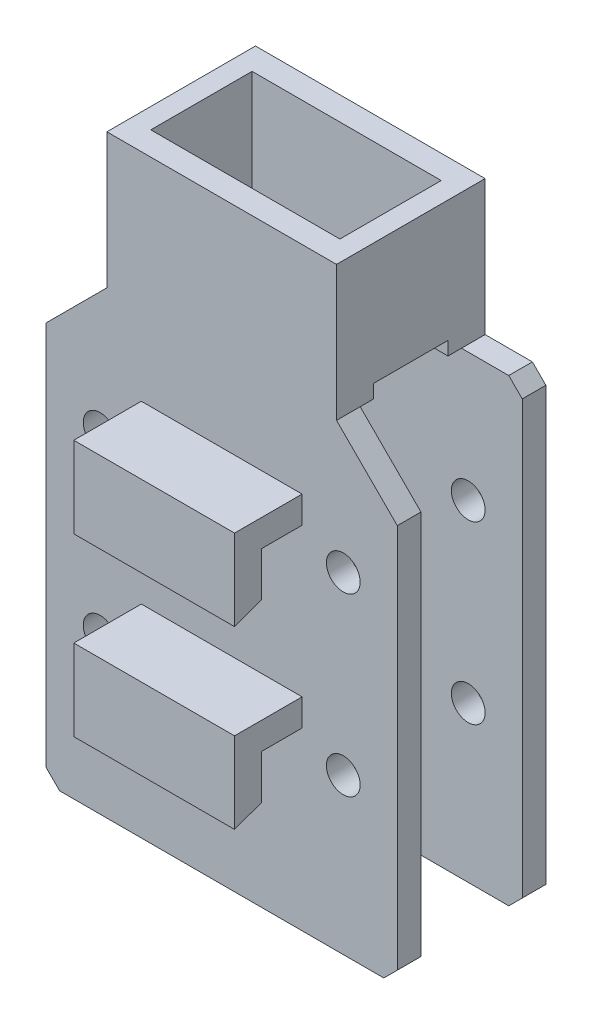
SolidWorks part; units mm, degrees
ref_plane "前视基准面" through (0, 0, 0) normal (0, 0, 1) x (1, 0, 0)
ref_plane "上视基准面" through (0, 0, 0) normal (0, 1, 0) x (1, 0, 0)
ref_plane "右视基准面" through (0, 0, 0) normal (1, 0, 0) x (0, 0, -1)
sketch "草图1" plane through (0, 0, 0) normal (0, 0, 1) x (1, 0, 0)
  line L0 (-24, 34) -> (-26, 32)
  line L1 (24, 34) -> (-24, 34)
  line L2 (26, 32) -> (26, -32)
  line L3 (24, -34) -> (-24, -34)
  line L4 (-26, 32) -> (-26, -32)
  line L5 (26, 34) -> (-26, -34) construction
  line L6 (26, -34) -> (-26, 34) construction
  line L7 (26, 32) -> (24, 34)
  line L8 (-24, -34) -> (-26, -32)
  line L9 (26, -32) -> (24, -34)
  point P0 (0, 0)
  dimension "D1" = 68
  dimension "D2" = 52
extrude "凸台-拉伸1" add sketch "草图1" along normal mid plane 22
sketch "草图2" plane through (0, 0, 0) normal (0, 0, 1) x (1, 0, 0)
  line L8 (24, 34) -> (-24, 34)
  line L9 (-24, 34) -> (-26, 32)
  line L10 (-26, 32) -> (-26, -32)
  line L11 (-26, -32) -> (-24, -34)
  line L12 (-24, -34) -> (24, -34)
  line L13 (24, -34) -> (26, -32)
  line L14 (26, -32) -> (26, 32)
  line L15 (26, 32) -> (24, 34)
  line L16 (24, 34) -> (-24, 34)
  line L17 (-24, 34) -> (-26, 32)
  line L18 (-26, 32) -> (-26, -32)
  line L19 (-26, -32) -> (-24, -34)
  line L20 (-24, -34) -> (24, -34)
  line L21 (24, -34) -> (26, -32)
  line L22 (26, -32) -> (26, 32)
  line L23 (26, 32) -> (24, 34)
  dimension "D1" = 0
extrude "切除-拉伸1" cut sketch "草图2" against normal mid plane 15
sketch "草图3" plane through (0, 34, 0) normal (0, 1, 0) x (1, 0, 0)
  line L0 (24, -11) -> (-24, -11) construction
  line L1 (17, 11) -> (-17, 11)
  line L2 (17, 11) -> (17, -11)
  line L3 (17, -11) -> (-17, -11)
  line L4 (-17, 11) -> (-17, -11)
  line L5 (17, 11) -> (-17, -11) construction
  line L6 (17, -11) -> (-17, 11) construction
  line L7 (24, -7.5) -> (-24, -7.5) construction
  line L8 (14, 7.5) -> (-14, 7.5)
  line L9 (14, 7.5) -> (14, -7.5)
  line L10 (14, -7.5) -> (-14, -7.5)
  line L11 (-14, 7.5) -> (-14, -7.5)
  line L12 (14, 7.5) -> (-14, -7.5) construction
  line L13 (14, -7.5) -> (-14, 7.5) construction
  point P0 (0, 0)
  point P8 (0, 0)
  dimension "D1" = 34
  dimension "D2" = 28
extrude "凸台-拉伸2" add sketch "草图3" along normal blind 20
sketch "草图6" plane through (0, 0, 0) normal (0, 0, 1) x (1, 0, 0)
  line L0 (0, 0) -> (0, 19.694) construction
  line L1 (-17, 34) -> (-24, 34) construction
  circle A0 centre (-18, 15) radius 2.5
  circle A1 centre (18, 15) radius 2.5
  dimension "D1" = 5
  dimension "D3" = 19
  dimension "D2" = 18
extrude "切除-拉伸2" cut sketch "草图6" against normal through all both and the other way through all
sketch "草图7" plane through (-17, 0, 0) normal (-1, 0, 0) x (0, 0, 1)
  line L0 (-7.5, 34) -> (7.5, 34) construction
  line L1 (5.5, 36) -> (-5.5, 36)
  line L2 (5.5, 36) -> (5.5, 32)
  line L3 (5.5, 32) -> (-5.5, 32)
  line L4 (-5.5, 36) -> (-5.5, 32)
  line L5 (5.5, 36) -> (-5.5, 32) construction
  line L6 (5.5, 32) -> (-5.5, 36) construction
  point P0 (0, 34)
  dimension "D1" = 11
  dimension "D2" = 4
extrude "切除-拉伸3" cut sketch "草图7" against normal through all both and the other way through all
sketch "草图8" plane through (0, 0, 11) normal (0, 0, 1) x (1, 0, 0)
  line L0 (0, 0) -> (0, -34) construction
  line L1 (-24, -34) -> (24, -34) construction
  circle A0 centre (-18, -11) radius 2.5
  circle A1 centre (-18, 15) radius 2.5 construction
  circle A2 centre (18, -11) radius 2.5
  dimension "D1" = 5
  dimension "D2" = 18
  dimension "D3" = 26
extrude "切除-拉伸4" cut sketch "草图8" against normal through all
sketch "草图9" plane through (0, 0, 11) normal (0, 0, 1) x (1, 0, 0)
  line L0 (0, -34) -> (0, -22) construction
  line L1 (-24, -34) -> (24, -34) construction
  dimension "D1" = 12
hole_wizard "M8 螺纹孔1" positions "3D草图2" profile "草图10" tap size "M8" standard "GB"
sketch3d "3D草图2"
  point P0 (0, -22, 11)
sketch "草图10" plane through (0, -22, 11) normal (1, 0, 0) x (0, -1, 0)
  line L0 (0, 0) -> (0, 24.0419)
  line L1 (0, 24.0419) -> (3.4, 21.999)
  line L2 (3.4, 21.999) -> (3.4, 0)
  line L5 (3.4, 0) -> (0, 0)
  line L10 (0, 24.0419) -> (-3.4, 21.999) construction
  line L11 (0, -6.35) -> (0, 107.95) construction
  dimension "螺纹孔钻头直径" = 6.8
  dimension "螺纹孔钻头深度" = 21.999
  dimension "导头角度" = 118
sketch "草图11" plane through (0, 0, 0) normal (1, 0, 0) x (0, 0, -1)
  line L0 (-11, -4) -> (-21, -4)
  line L1 (-11, -32) -> (-11, 32) construction
  line L2 (-21, -4) -> (-21, -16)
  line L3 (-21, -16) -> (-17, -14.5441)
  line L4 (-17, -14.5441) -> (-17, -8)
  line L5 (-17, -8) -> (-11, -8)
  line L6 (-11, -8) -> (-11, -4)
  line L7 (-11, -22) -> (11, -22) construction
  line L8 (-11, 34) -> (-7.5, 34) construction
  line L9 (11, -32) -> (11, 32) construction
  dimension "D1" = 10
  dimension "D2" = 6
  dimension "D3" = 4
  dimension "D4" = 70
  dimension "D5" = 12
  dimension "D6" = 56
  dimension "D7" = 18
extrude "凸台-拉伸3" add sketch "草图11" along normal mid plane 23.8
pattern_linear "阵列(线性)1" count 2 spacing 26 along (0, 1, 0) of "凸台-拉伸3"
sketch "草图12" plane through (0, 0, -11) normal (0, 0, -1) x (-1, 0, 0)
  line L0 (-18, 15) -> (-37.8997, 45) construction
  line L1 (-37.8997, 45) -> (-18, 45) construction
  line L2 (-18, 45) -> (-18, 15) construction
  line L3 (0, 0) -> (0, 72.1324) construction
  circle A0 centre (-18, 15) radius 36
  circle A1 centre (-37.8997, 45) radius 18
  dimension "D1" = 72
  dimension "D2" = 36
  dimension "D3" = 30
sketch "草图13" plane through (0, 0, 11) normal (0, 0, 1) x (1, 0, 0)
  line L0 (17, 34) -> (26, 25)
  line L1 (26, -32) -> (26, 32) construction
  line L2 (26, 25) -> (26, 32)
  line L3 (26, 32) -> (24, 34)
  line L4 (24, 34) -> (17, 34)
  line L5 (0, 0) -> (0, 10) construction
  line L6 (11.9, 10) -> (-11.9, 10) construction
  line L7 (-24, 34) -> (-17, 34)
  line L8 (-26, 32) -> (-24, 34)
  line L9 (-26, 25) -> (-26, 32)
  line L10 (-17, 34) -> (-26, 25)
extrude "切除-拉伸5" cut sketch "草图13" against normal up to next
